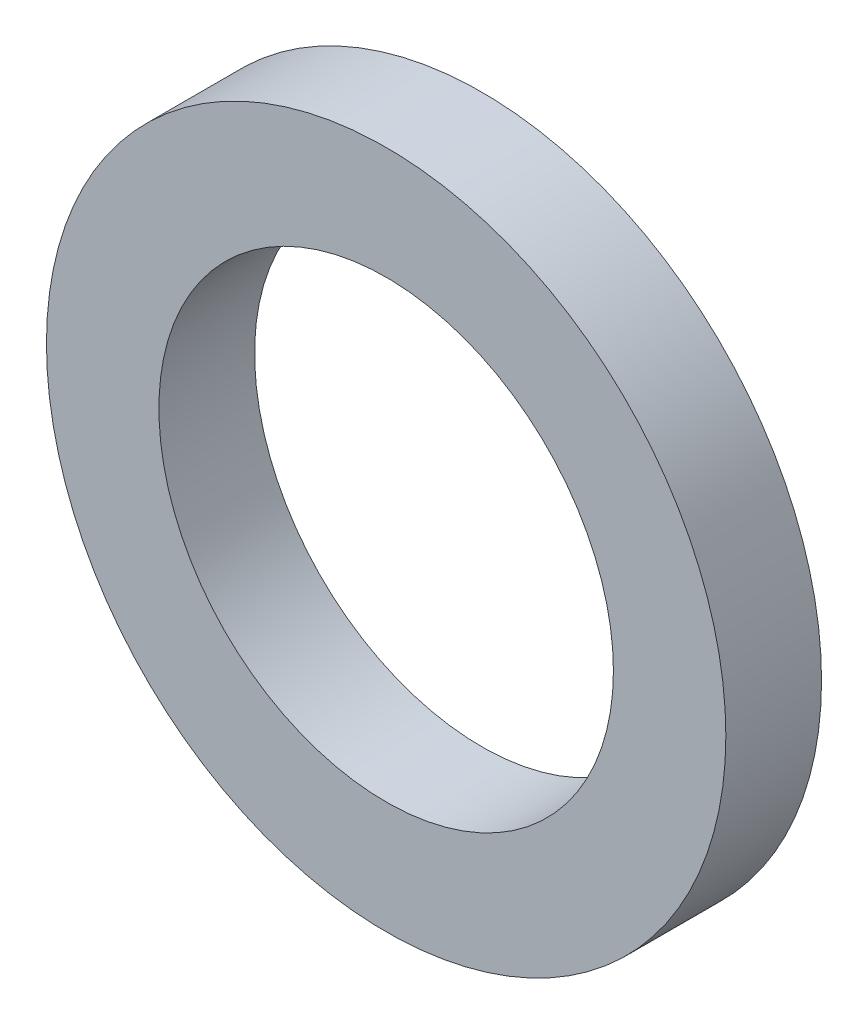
SolidWorks part; units mm, degrees
ref_plane "Face" through (0, 0, 0) normal (0, 0, 1) x (1, 0, 0)
ref_plane "Dessus" through (0, 0, 0) normal (0, 1, 0) x (1, 0, 0)
ref_plane "Droite" through (0, 0, 0) normal (1, 0, 0) x (0, 0, -1)
sketch "Esquisse1" plane through (0, 0, 0) normal (0, 0, 1) x (1, 0, 0)
  circle A0 centre (0, 0) radius 4.75
  circle A1 centre (0, 0) radius 7.1
  dimension "D1" = 14.2
  dimension "D2" = 9.5
extrude "Extrusion1" add sketch "Esquisse1" along normal blind 2
